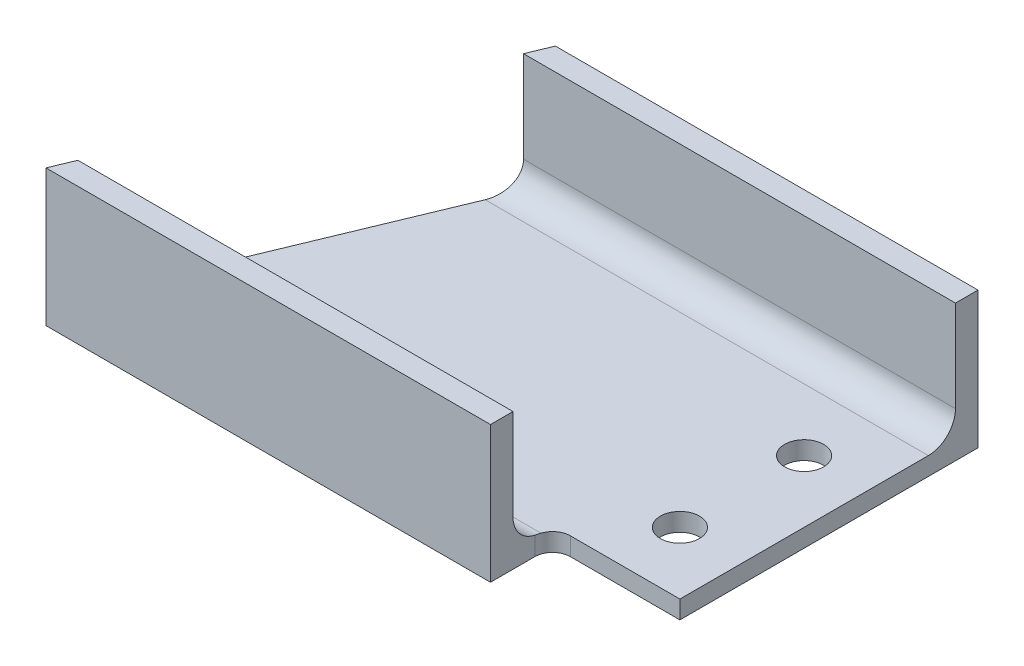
SolidWorks part; units mm, degrees
ref_plane "Front Plane" through (0, 0, 0) normal (0, 0, 1) x (1, 0, 0)
ref_plane "Top Plane" through (0, 0, 0) normal (0, 1, 0) x (1, 0, 0)
ref_plane "Right Plane" through (0, 0, 0) normal (1, 0, 0) x (0, 0, -1)
ref_plane "Member Plane" through (0, 0, 0) normal (0, 1, 0) x (-1, 0, 0)
sketch "Member Sketch" plane through (0, 0, 0) normal (0, 1, 0) x (1, 0, 0)
  line L0 (0, 0) -> (345, 0)
  line L2 (0, 0) -> (345, 0) construction
other "Structural Member1"
ref_plane "Plane1" through (0, 21.3, -101.5) normal (1, 0, 0) x (0, 1, 0)
sketch "Sketch17" plane through (0, 21.3, -101.5) normal (1, 0, 0) x (0, 1, 0)
  line L0 (-21.3, 101.5) -> (-21.3, -101.5)
  line L1 (0, 0) -> (-21.3, 0) construction
  line L2 (-21.3, 101.5) -> (55.7, 101.5)
  line L3 (55.7, 88.8) -> (4.2, 88.8)
  line L4 (-11.1, 73.5) -> (-11.1, -73.5)
  line L5 (55.7, 101.5) -> (55.7, 88.8)
  line L6 (55.7, -101.5) -> (55.7, -88.8)
  line L7 (55.7, -88.8) -> (4.2, -88.8)
  line L8 (-21.3, -101.5) -> (55.7, -101.5)
  line L9 (17.2, 101.5) -> (17.2, -101.5) construction
  line L10 (-21.3, 0) -> (55.7, 0) construction
  line L11 (55.7, 88.8) -> (55.7, -88.8) construction
  line L12 (0, 101.5) -> (0, -101.5) construction
  arc A0 (-11.1, -73.5) -> (4.2, -88.8) centre (4.2, -73.5) ccw
  arc A1 (-11.1, 73.5) -> (4.2, 88.8) centre (4.2, 73.5) cw
  point P10 (-11.1, 0)
  point P19 (-11.1, -101.5)
  point P20 (-21.3, -88.8)
  point P21 (-21.3, 88.8)
  point P22 (-11.1, 101.5)
  point P25 (0, 0)
  point P31 (17.2, 0)
  dimension "Root Radius(r1)" = 15.3
  dimension "Flange Thickness(T)" = 12.7
  dimension "Section Depth(D)" = 203
  dimension "Flange Width(B)" = 77
  dimension "Web Thickness(W)" = 10.2
  dimension "Centroid(X)" = 21.3
  dimension "FlangeWebToe(K)" = 28
ref_plane "Plane2" through (0, 0, 0) normal (-0.9239, 0, -0.3827) x (-0.3827, 0, 0.9239)
other "Trim/Extend1"
other "0008-AABE002-CN02-FP03D02-1 - MEMBER2 CAVITY"
other "0008-AABE002<1>@0008-AA/0008-AABE002-CN02-FP03<1>@0008-AABE002/0008-AABE002-CN02-FP03D02<1>@0008-AABE002-CN02-FP031"
other "0008-AABE002-CN02-FP03D01-1 - MEMBER2 CAVITY"
other "0008-AABE002<1>@0008-AA/0008-AABE002-CN02-FP03<1>@0008-AABE002/0008-AABE002-CN02-FP03D01<1>@0008-AABE002-CN02-FP031"
